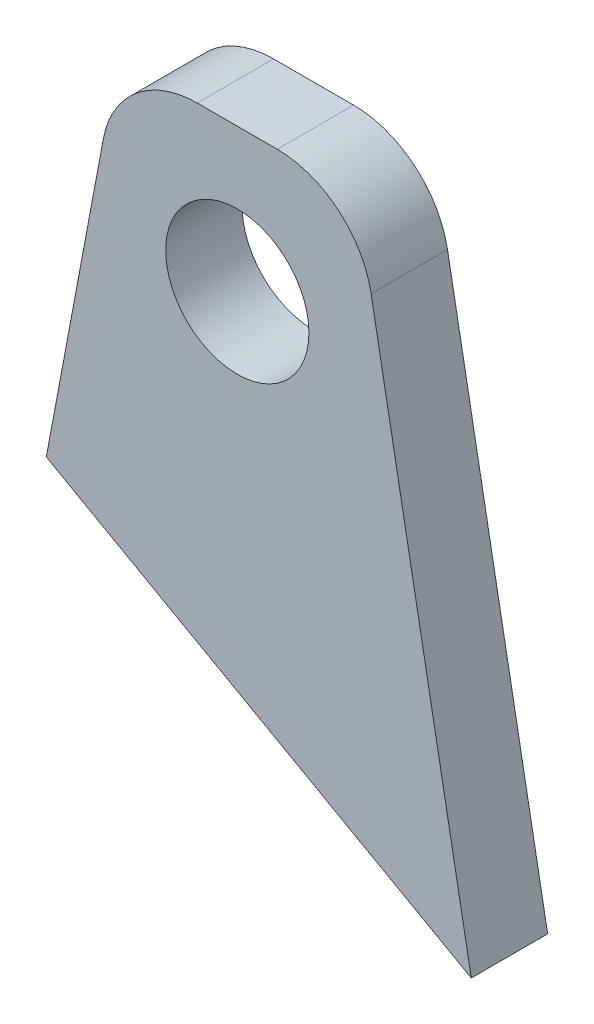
SolidWorks part; units mm, degrees
ref_plane "前视基准面" through (0, 0, 0) normal (0, 0, 1) x (1, 0, 0)
ref_plane "上视基准面" through (0, 0, 0) normal (0, 1, 0) x (1, 0, 0)
ref_plane "右视基准面" through (0, 0, 0) normal (1, 0, 0) x (0, 0, -1)
sketch "草图1" plane through (0, 0, 0) normal (0, 0, 1) x (1, 0, 0)
  line L0 (-40, 0) -> (40, 0) construction
  line L1 (-8.4015, 30) -> (8.3543, 30)
  line L3 (0, 40) -> (0, -40) construction
  line L4 (-19.7181, 0) -> (27.2192, 0) construction
  line L10 (-19.7181, 30) -> (27.2192, 30) construction
  line L16 (28.022, 13.6309) -> (49, -100)
  line L17 (-28.0589, 13.6858) -> (-40, -50)
  line L18 (49, -100) -> (-40, -50)
  circle A0 centre (0, 0) radius 15
  arc A1 (-8.4015, 30) -> (-28.0589, 13.6858) centre (-8.4015, 10) ccw
  arc A2 (28.022, 13.6309) -> (8.3543, 30) centre (8.3543, 10) ccw
  point P11 (-25, 30)
  point P17 (25, 30)
  dimension "D1" = 30
  dimension "D4" = 80
  dimension "D5" = 25
  dimension "D6" = 25
  dimension "D8" = 49
  dimension "D9" = 20
  dimension "D3" = 130
  dimension "D7" = 40
  dimension "D2" = 30
extrude "拉伸1" add sketch "草图1" along normal blind 16
